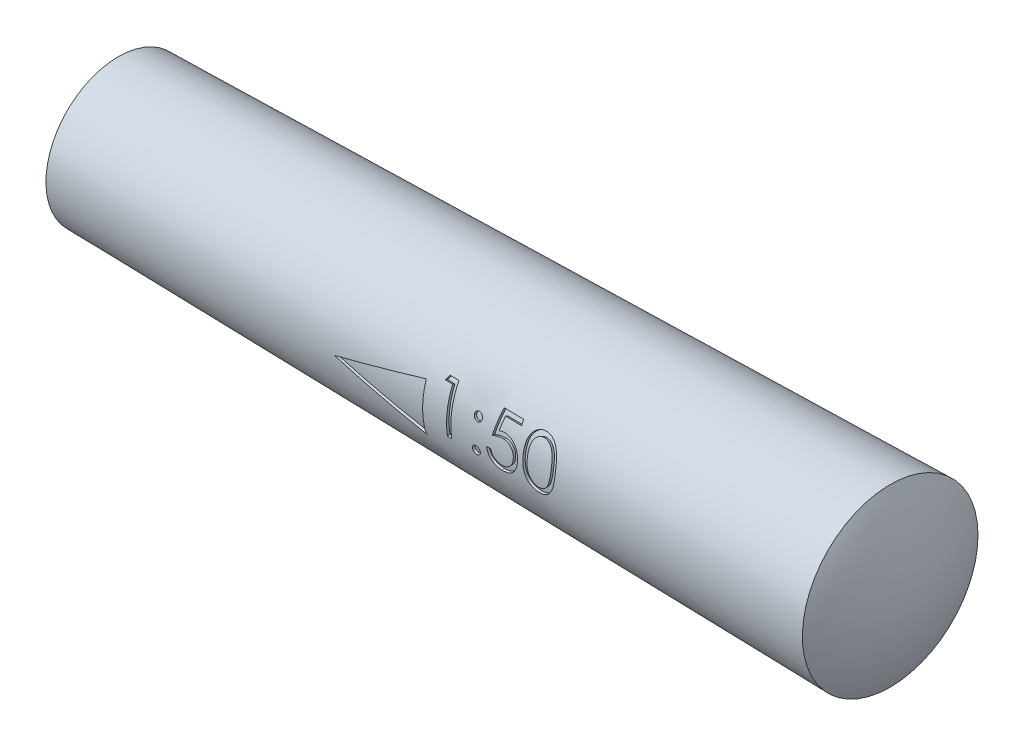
SolidWorks part; units mm, degrees
ref_plane "Front Plane" through (0, 0, 0) normal (0, 0, 1) x (1, 0, 0)
ref_plane "Top Plane" through (0, 0, 0) normal (0, 1, 0) x (1, 0, 0)
ref_plane "Right Plane" through (0, 0, 0) normal (1, 0, 0) x (0, 0, -1)
sketch "Sketch1" plane through (0, 0, 0) normal (1, 0, 0) x (0, 0, -1)
  circle A0 centre (0, 0) radius 1.5
  dimension "D1" = 3
extrude "Extrude1" add sketch "Sketch1" along normal mid plane 16
draft "Draft1" type of draft neutral plane draft angle 1.146 faces to draft 1 parameters "D1"=1.146
sketch "Sketch2" plane through (0, 0, 0) normal (0, 0, 1) x (1, 0, 0)
  line L0 (-8, 0) -> (-8, 1.5)
  line L1 (-8, 1.5) -> (-8, -1.5) construction
  line L2 (-8, 0) -> (-8.45, 0)
  line L3 (-8.45, 0) -> (-8.45, -1.66) construction
  line L4 (8, 0) -> (8, 1.82)
  line L5 (8, -1.82) -> (8, 1.82) construction
  line L6 (8, 0) -> (8.45, 0)
  line L7 (8.45, 0) -> (8.45, -1.66) construction
  line L8 (-8, -1.5) -> (8, -1.82) construction
  arc A0 (-8.45, 0) -> (-8, 1.5) centre (-5.725, 0) cw
  arc A1 (8.45, 0) -> (8, 1.82) centre (4.5445, 0) ccw
  point P14 (0, -1.66)
revolve "Revolve1" add sketch "Sketch2" angle 360 about L2
sketch "Sketch5" plane through (0, 0, 0) normal (0, 0, 1) x (1, 0, 0)
  line L0 (0, 1.66) -> (0, -1.66) construction
  line L1 (8, 1.82) -> (-8, 1.5) construction
  line L2 (-8, -1.5) -> (8, -1.82) construction
ref_plane "Plane2" through (0, 0, 0) normal (-0.02, 0, 0.9998) x (0.9998, 0, 0.02)
sketch "Sketch6" plane through (0, 0, 0) normal (-0.02, 0, 0.9998) x (0.9998, 0, 0.02)
  line L0 (0, 0) -> (0, 0.5)
  line L1 (0, 1.66) -> (0, -1.66) construction
  line L2 (0, 0.5) -> (-1.866, 0)
  line L3 (-1.866, 0) -> (0, -0.5)
  line L4 (0, -0.5) -> (0, 0)
  line L5 (0, -0.25) -> (3, -0.25) construction
  text T0 "1:50" font "Century Gothic" height 1
  dimension "D1" = 1
  dimension "D2" = 30
  dimension "D3" = 3
wrap "Wrap2" sketch "Sketch6" wrap type deboss source sketch "Sketch6" thickness 0.05 parameters "D1"=0.05
equation "\"D2@Sketch2\" = \"D1@Sketch2\""
